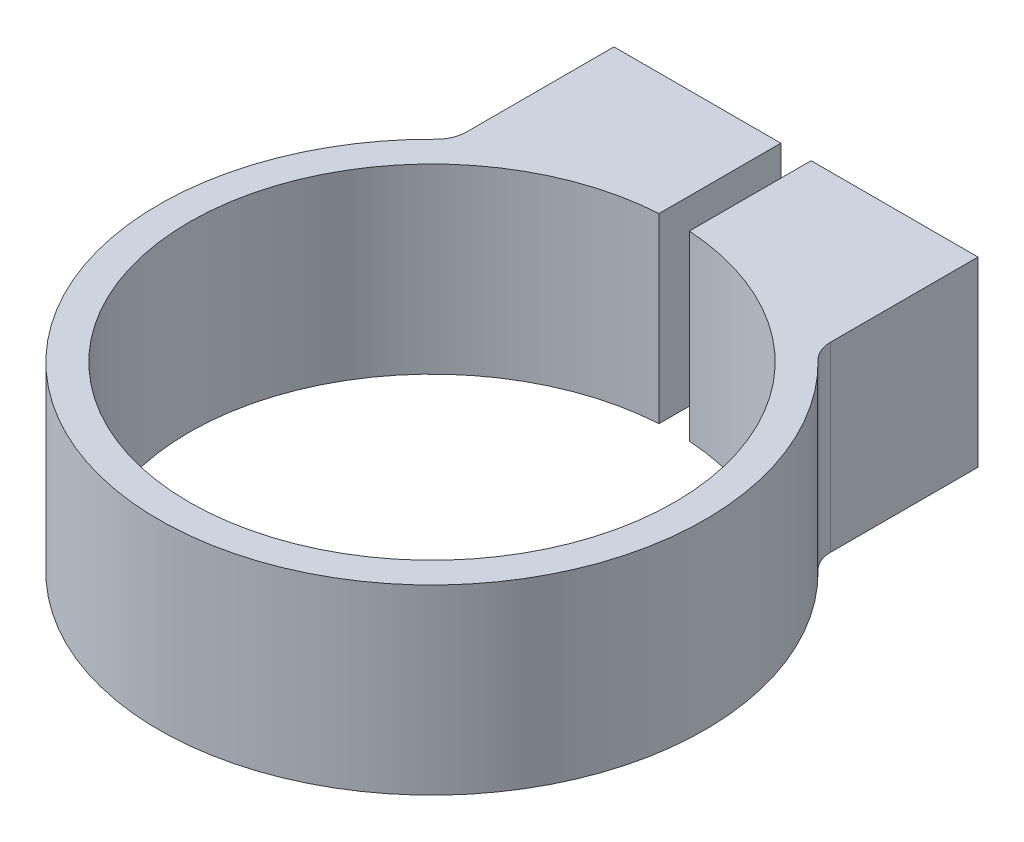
SolidWorks part; units mm, degrees
ref_plane "Front Plane" through (0, 0, 0) normal (0, 0, 1) x (1, 0, 0)
ref_plane "Top Plane" through (0, 0, 0) normal (0, 1, 0) x (1, 0, 0)
ref_plane "Right Plane" through (0, 0, 0) normal (1, 0, 0) x (0, 0, -1)
sketch "Sketch1" plane through (0, 0, 0) normal (0, 1, 0) x (1, 0, 0)
  line L1 (-38.1, 76.2) -> (38.1, 76.2)
  line L2 (-38.1, 76.2) -> (-38.1, 42.5971)
  line L4 (38.1, 76.2) -> (38.1, 42.5971)
  circle A0 centre (0, 0) radius 50.8
  arc A1 (-38.1, 42.5971) -> (38.1, 42.5971) centre (0, 0) ccw
  dimension "D1" = 76.2
  dimension "D2" = 38.1
  dimension "D3" = 76.2
extrude "Extrude1" add sketch "Sketch1" against normal blind 38.1
fillet "Fillet1" radius 6.35 2 edges at (-38.1, -19.05, -42.5971) (38.1, -19.05, -42.5971)
sketch "Sketch2" plane through (0, 0, 0) normal (0, 1, 0) x (-1, 0, 0)
  line L1 (3.175, -82.6864) -> (-3.175, -82.6864)
  line L2 (3.175, -82.6864) -> (3.175, -38.8178)
  line L3 (3.175, -38.8178) -> (-3.175, -38.8178)
  line L4 (-3.175, -82.6864) -> (-3.175, -38.8178)
  dimension "D1" = 6.35
  dimension "D2" = 3.175
extrude "Cut-Extrude1" cut sketch "Sketch2" against normal through all
